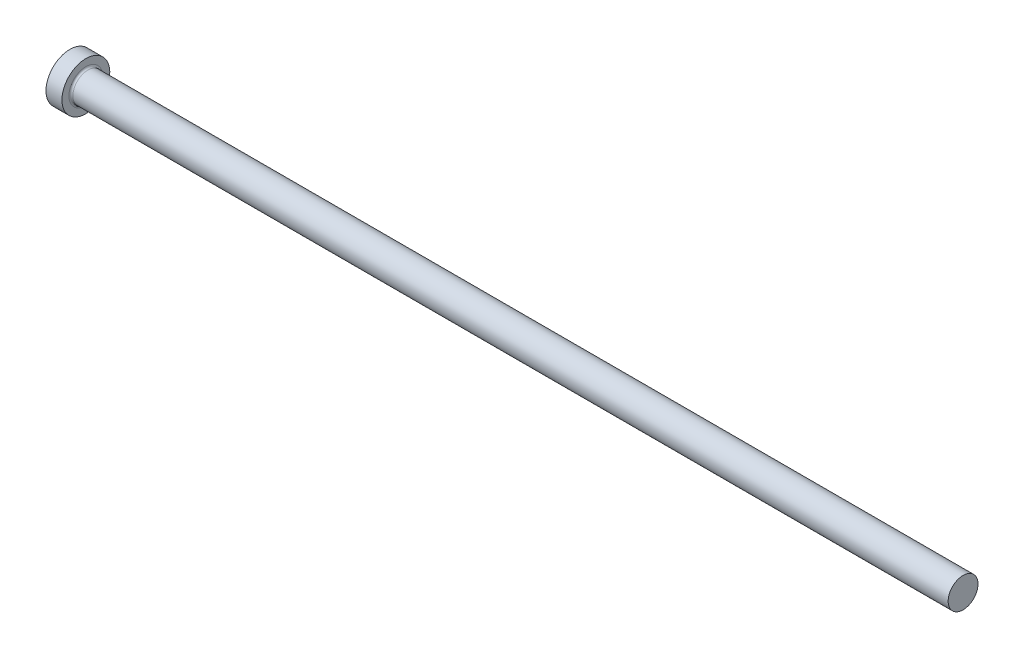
SolidWorks part; units mm, degrees
ref_plane "Front Plane" through (0, 0, 0) normal (0, 0, 1) x (1, 0, 0)
ref_plane "Top Plane" through (0, 0, 0) normal (0, 1, 0) x (1, 0, 0)
ref_plane "Right Plane" through (0, 0, 0) normal (1, 0, 0) x (0, 0, -1)
sketch "Sketch1" plane through (0, 0, 0) normal (0, 0, 1) x (1, 0, 0)
  line L0 (0, 0) -> (0, 9.525)
  line L1 (0, 9.525) -> (6.35, 9.525)
  line L2 (6.35, 9.525) -> (6.35, 6.7348)
  line L3 (7.1374, 5.9474) -> (355.6, 5.9474)
  line L4 (355.6, 5.9474) -> (355.6, 0)
  line L5 (355.6, 0) -> (0, 0)
  line L6 (355.6, 0) -> (0, 0) construction
  line L7 (0, 0) -> (-10.4771, 0) construction
  line L8 (355.6, 0) -> (1002.3976, 0) construction
  arc A0 (7.1374, 5.9474) -> (6.35, 6.7348) centre (7.1374, 6.7348) cw
  dimension "D1" = 0.7874
  dimension "HeadDia" = 19.05
  dimension "HeadThickness" = 6.35
  dimension "PinDia" = 11.8948
  dimension "overall" = 355.6
revolve "PIN" add sketch "Sketch1" angle 360 about L6
